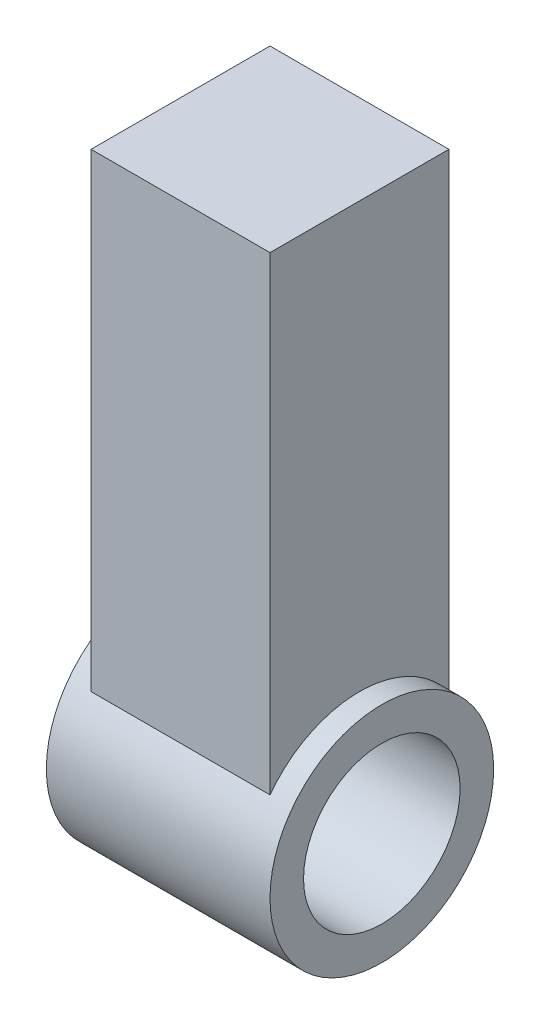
SolidWorks part; units mm, degrees
ref_plane "Vorne" through (0, 0, 0) normal (0, 0, 1) x (1, 0, 0)
ref_plane "Oben" through (0, 0, 0) normal (0, 1, 0) x (1, 0, 0)
ref_plane "Rechts" through (0, 0, 0) normal (1, 0, 0) x (0, 0, -1)
sketch "Skizze1" plane through (0, 0, 0) normal (1, 0, 0) x (0, 0, -1)
  line L0 (0, 0) -> (0, 85)
  line L1 (0, 85) -> (40, 85)
  line L2 (40, 85) -> (40, 10.718)
  line L3 (40, 10.718) -> (0, 0)
  dimension "D1" = 40
  dimension "D2" = 85
  dimension "D3" = 75
extrude "Linear austragen1" add sketch "Skizze1" along normal mid plane 40
sketch "Skizze2" plane through (0, 0, 0) normal (1, 0, 0) x (0, 0, -1)
  line L0 (20, -915) -> (20, 49085) construction
  line L1 (40, 85) -> (0, 85) construction
  circle A0 centre (20, -35) radius 25
  circle A1 centre (20, -35) radius 17.5
  point P8 (20, 85)
  dimension "D2" = 50
  dimension "D3" = 35
  dimension "D1" = 35
extrude "Linear austragen2" add sketch "Skizze2" along normal mid plane 50
sketch "Skizze3" plane through (0, 0, 0) normal (0, 1, 0) x (1, 0, 0)
  line L4 (-20, 40) -> (-20, 0)
  line L5 (20, 40) -> (-20, 40)
  line L6 (20, 0) -> (20, 40)
  line L7 (-20, 0) -> (20, 0)
  line L8 (-20, 40) -> (-20, 0)
  line L9 (20, 40) -> (-20, 40)
  line L10 (20, 0) -> (20, 40)
  line L11 (-20, 0) -> (20, 0)
  dimension "D1" = 0
extrude "Linear austragen3" add sketch "Skizze3" along normal up to surface and the other way up to surface
